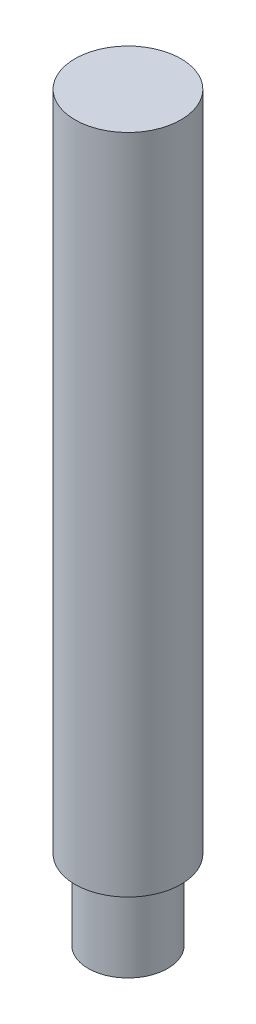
SolidWorks part; units mm, degrees
ref_plane "Front Plane" through (0, 0, 0) normal (0, 0, 1) x (1, 0, 0)
ref_plane "Top Plane" through (0, 0, 0) normal (0, 1, 0) x (1, 0, 0)
ref_plane "Right Plane" through (0, 0, 0) normal (1, 0, 0) x (0, 0, -1)
sketch "Sketch1" plane through (0, 0, 0) normal (0, 1, 0) x (1, 0, 0)
  circle A0 centre (0, 0) radius 3
  dimension "D1" = 6
extrude "Extrude1" add sketch "Sketch1" along normal blind 6
sketch "Sketch2" plane through (0, 6, 0) normal (0, 1, 0) x (1, 0, 0)
  circle A0 centre (0, 0) radius 4
  dimension "D1" = 8
extrude "Extrude2" add sketch "Sketch2" along normal blind 50
